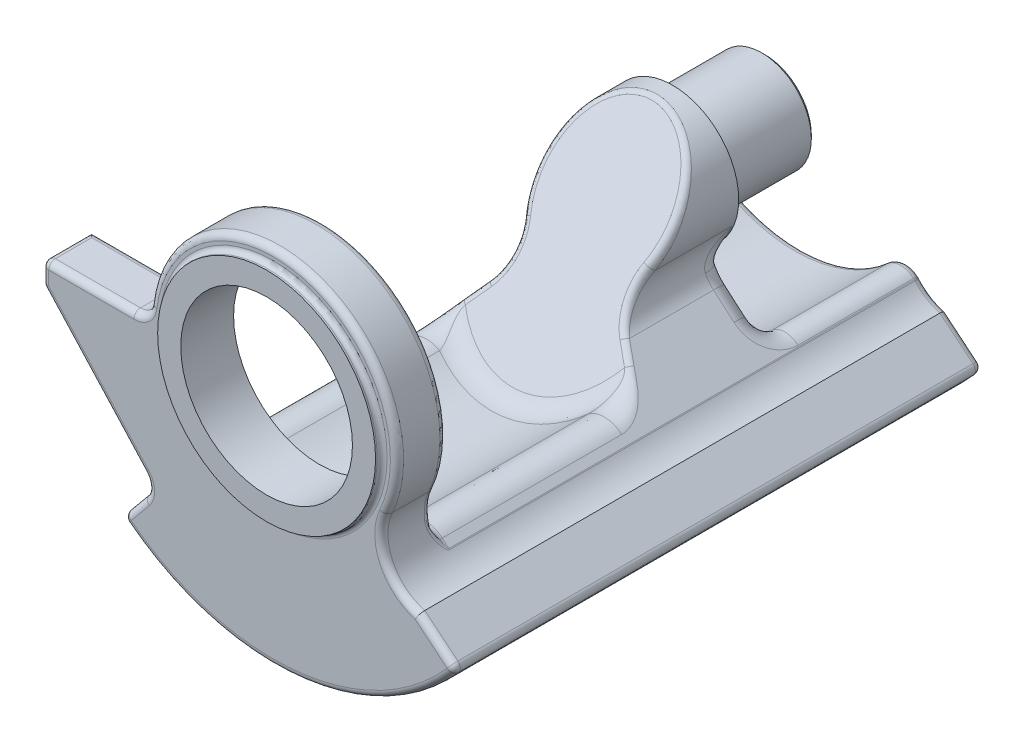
SolidWorks part; units mm, degrees
ref_plane "Plan de face" through (0, 0, 0) normal (0, 0, 1) x (1, 0, 0)
ref_plane "Plan de dessus" through (0, 0, 0) normal (0, 1, 0) x (1, 0, 0)
ref_plane "Plan de droite" through (0, 0, 0) normal (1, 0, 0) x (0, 0, -1)
other "Centre de masse"
sketch "Esquisse1" plane through (0, 0, 0) normal (0, 0, 1) x (1, 0, 0)
  line L0 (0, 57.9021) -> (0, -96.26) construction
  line L1 (0, 0) -> (108.6423, 0) construction
  line L2 (0, 0) -> (-55.5055, -45.86) construction
  line L3 (0, 0) -> (-61.5936, 0) construction
  line L4 (42.2049, 0) -> (70, 0)
  line L5 (70, 0) -> (70, -7)
  line L6 (45.86, -55.5055) -> (39.0709, -47.2886)
  line L7 (39.2313, -40.7344) -> (70, -7)
  line L8 (-55.5055, -45.86) -> (-43.9419, -36.3058)
  line L11 (45.86, -55.5055) -> (0, 0) construction
  arc A1 (37.2396, 4.4118) -> (-34.1143, -15.5713) centre (0, 0) ccw
  arc A2 (-55.5055, -45.86) -> (45.86, -55.5055) centre (0, 0) ccw
  arc A3 (39.0709, -47.2886) -> (39.2313, -40.7344) centre (42.9255, -44.1038) cw
  arc A4 (37.2396, 4.4118) -> (42.2049, 0) centre (42.2049, 5) ccw
  arc A5 (-34.1143, -15.5713) -> (-43.9419, -36.3058) centre (-47.76, -21.7999) cw
  point P18 (36.3058, -43.9419)
  point P21 (37.5, 0)
  dimension "D2" = 37.5
  dimension "D9" = 5
  dimension "D10" = 15
  dimension "D11" = 72
  dimension "D3" = 15
  dimension "D4" = 70
  dimension "D5" = 15
  dimension "D6" = 7
  dimension "D7" = 50
  dimension "D8" = 90
extrude "Boss.-Extru.1" add sketch "Esquisse1" along normal blind 15
sketch "Esquisse3" plane through (0, 0, 15) normal (0, 0, 1) x (1, 0, 0)
  circle A0 centre (0, 0) radius 33
  dimension "D1" = 66
extrude "Boss.-Extru.2" add sketch "Esquisse3" along normal blind 2
sketch "Esquisse4" plane through (0, 0, 17) normal (0, 0, 1) x (1, 0, 0)
  circle A0 centre (0, 0) radius 26
  dimension "D1" = 52
extrude "Enlèv. mat.-Extru.1" cut sketch "Esquisse4" against normal up to next
fillet "Congé1" radius 1.5 1 edges at (-33, 0, 15)
sketch "Esquisse5" plane through (0, 0, 0) normal (0, 0, -1) x (-1, 0, 0)
  line L0 (-45.86, -55.5055) -> (-24.2039, -29.2946)
  line L1 (43.9419, -36.3058) -> (55.5055, -45.86) construction
  line L2 (55.5055, -45.86) -> (43.9419, -36.3058)
  line L4 (0, 0) -> (39.7652, -34.4917) construction
  line L5 (36.3253, -31.508) -> (28.706, -24.8991)
  arc A0 (-45.86, -55.5055) -> (55.5055, -45.86) centre (0, 0) ccw
  arc A1 (-24.2039, -29.2946) -> (28.706, -24.8991) centre (0, 0) ccw
  arc A2 (43.9419, -36.3058) -> (36.3253, -31.508) centre (47.76, -21.7999) cw
  arc A3 (34.1143, -15.5713) -> (43.9419, -36.3058) centre (47.76, -21.7999) ccw construction
  dimension "D1" = 34
extrude "Boss.-Extru.3" add sketch "Esquisse5" along normal blind 145
sketch "Esquisse6" plane through (0, 0, 0) normal (0, 0, -1) x (-1, 0, 0)
  circle A0 centre (0, 0) radius 35
  dimension "D1" = 70
extrude "Enlèv. mat.-Extru.2" cut sketch "Esquisse6" against normal blind 1
sketch "Esquisse7" plane through (0, 0, -145) normal (0, 0, -1) x (-1, 0, 0)
  line L3 (-45.86, -55.5055) -> (-26.7517, -32.3782)
  line L4 (-24.2039, -29.2946) -> (-39.0709, -47.2886) construction
  line L5 (36.3253, -31.508) -> (28.706, -24.8991) construction
  line L6 (55.5055, -45.86) -> (43.9419, -36.3058)
  line L7 (36.3253, -31.508) -> (28.706, -24.8991)
  line L8 (-24.2039, -29.2946) -> (-45.86, -55.5055)
  line L9 (55.5055, -45.86) -> (43.9419, -36.3058)
  line L10 (31.7277, -27.5201) -> (36.3253, -31.508)
  arc A3 (-26.7517, -32.3782) -> (31.7277, -27.5201) centre (0, 0) ccw
  arc A6 (-45.86, -55.5055) -> (55.5055, -45.86) centre (0, 0) ccw
  arc A7 (36.3253, -31.508) -> (43.9419, -36.3058) centre (47.76, -21.7999) ccw
  arc A8 (-24.2039, -29.2946) -> (28.706, -24.8991) centre (0, 0) ccw
  arc A9 (-45.86, -55.5055) -> (55.5055, -45.86) centre (0, 0) ccw
  arc A10 (36.3253, -31.508) -> (43.9419, -36.3058) centre (47.76, -21.7999) ccw
  dimension "D2" = 30
  dimension "D1" = 0
extrude "Enlèv. mat.-Extru.3" cut sketch "Esquisse7" against normal blind 42 flip side to cut
ref_plane "Plan1" through (0, 0, -55) normal (0, 0, 1) x (1, 0, 0)
sketch "Esquisse17" plane through (0, 0, -55) normal (0, 0, 1) x (1, 0, 0)
  line L0 (0, -38) -> (-33.3969, -38) construction
  arc A3 (-28.706, -24.8991) -> (24.2039, -29.2946) centre (0, 0) ccw construction
  arc A4 (-28.706, -24.8991) -> (24.2039, -29.2946) centre (0, 0) ccw construction
ref_plane "Plan2" through (0, -41.0866, -52.5885) normal (0, 0.6157, 0.788) x (1, 0, 0)
sketch "Esquisse9" plane through (0, 0, -103) normal (0, 0, -1) x (-1, 0, 0)
  line L0 (-26.7517, -32.3782) -> (0, 0) construction
  line L2 (0, 0) -> (30.2168, -26.2096) construction
  line L3 (31.7277, -27.5201) -> (28.706, -24.8991) construction
  line L4 (-26.7517, -32.3782) -> (-12.7389, -15.4182)
  line L5 (31.7277, -27.5201) -> (15.1084, -13.1048)
  arc A0 (-12.7389, -15.4182) -> (15.1084, -13.1048) centre (0, 0) cw
  arc A1 (-26.7517, -32.3782) -> (31.7277, -27.5201) centre (0, 0) ccw
  arc A2 (-26.7517, -32.3782) -> (31.7277, -27.5201) centre (0, 0) ccw construction
  dimension "D1" = 20
extrude "Boss.-Extru.4" add sketch "Esquisse9" against normal up to surface (37.7645 mm away) contours A0 L4 L5 M4
sketch "Esquisse10" plane through (0, 0, -103) normal (0, 0, -1) x (-1, 0, 0)
  circle A0 centre (0, 0) radius 20
  dimension "D1" = 40
extrude "Boss.-Extru.5" add sketch "Esquisse10" along normal blind 3
sketch "Esquisse11" plane through (0, 0, -106) normal (0, 0, -1) x (-1, 0, 0)
  circle A0 centre (0, 0) radius 15
  dimension "D1" = 30
extrude "Boss.-Extru.6" add sketch "Esquisse11" along normal blind 28
chamfer "Chanfrein1" distance 1 angle 45 1 edges at (-15, 0, -134)
fillet "Congé2" radius 5 1 edges at (-3.4771, -41.8558, -103)
fillet "Congé3" radius 2 29 edges at (-55.5055, -45.86, -65) (45.86, -55.5055, -65) (-6.8204, -71.6762, -145) (-6.8204, -71.6762, 15) (36.3058, -43.9419, -145) (-3.4771, -41.8558, -145) (-34.0265, -29.5141, -145) (-39.7652, -34.4917, -145) (-49.7237, -41.0829, -145) (38.8838, 1.2623, 15) (-10.113, 36.1106, 15) (-34.2054, -28.2244, 15) (-49.7237, -41.0829, 15) (42.4654, -51.397, 15) (37.927, -43.9815, 15) (54.6156, -23.8672, 15) (70, -3.5, 15) (56.1024, 0, 15) (70, -7, 7.5) (70, 0, 7.5) (54.6156, -23.8672, 0) (-10.113, 36.1106, 0) (38.8838, 1.2623, 0) (56.1024, 0, 0)
fillet "Congé4" radius 2.5 1 edges at (-1.6558, -19.9313, -103)
fillet "Congé8" radius 10 2 edges at (-15.1084, -13.1048, -89.9751) (12.7389, -15.4182, -89.0714)
fillet "Congé19" radius 8 1 edges at (-3.146, -37.8695, -55.1019)
fillet "Congé variable1" radius 8 4 edges at (15.7688, -14.4956, -103.2457) (16.4275, -19.1182, -103) (20.7912, -25.1641, -103) (25.8189, -31.2492, -104.4645)
fillet "Congé variable7" radius 8 8 edges at (-23.146, -20.0765, -69.0033) (-28.706, -24.8991, -30.5894) (-27.0085, -23.4268, -65.5498) (-18.2075, -13.3637, -74.248) (1.6558, 19.9313, -100.2609) (15.7527, -16.185, -72.0438) (19.7188, -23.8661, -66.0426) (23.7943, -28.7989, -59.922)
fillet "Congé21" radius 6 6 edges at (-31.753, -27.8845, -143.9838) (-17.9446, -11.6949, -103.2457) (-19.357, -16.1454, -103) (-24.6585, -21.3884, -103) (-30.6214, -26.5605, -104.4645) (-31.7277, -27.5201, -125.5)
move or copy body "Corps-Déplacer/Copier1" bodies to move or copy 110
